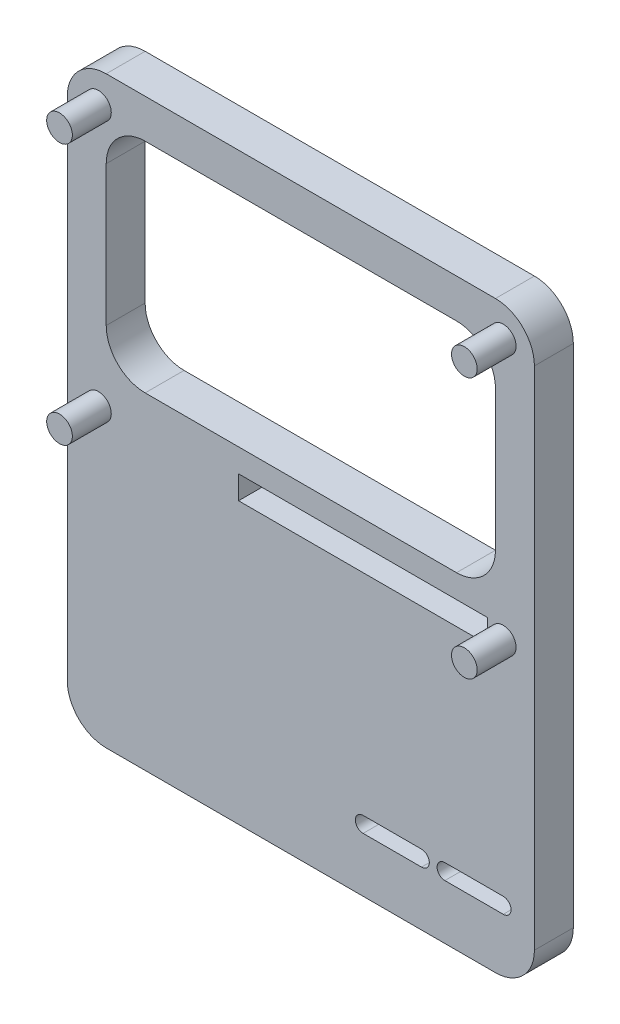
SolidWorks part; units mm, degrees
ref_plane "Alzado" through (0, 0, 0) normal (0, 0, 1) x (1, 0, 0)
ref_plane "Planta" through (0, 0, 0) normal (0, 1, 0) x (1, 0, 0)
ref_plane "Vista lateral" through (0, 0, 0) normal (1, 0, 0) x (0, 0, -1)
sketch "Croquis1" plane through (0, 0, 0) normal (0, 0, 1) x (1, 0, 0)
  line L0 (-15, -17.5) -> (-5, -17.5)
  line L1 (-25, 37.5) -> (25, 37.5)
  line L2 (-30, 32.5) -> (-30, -32.5)
  line L3 (-25, -37.5) -> (25, -37.5)
  line L4 (30, 32.5) -> (30, -32.5)
  line L5 (-30, 37.5) -> (30, -37.5) construction
  line L6 (-30, -37.5) -> (30, 37.5) construction
  line L7 (-20, 32.5) -> (20, 32.5)
  line L8 (-25, 27.5) -> (-25, 9.5)
  line L9 (-20, 4.5) -> (20, 4.5)
  line L10 (25, 27.5) -> (25, 9.5)
  line L11 (-25, 32.5) -> (25, 4.5) construction
  line L12 (-25, 4.5) -> (25, 32.5) construction
  line L13 (-5, -17.5) -> (-10, -8.8397)
  line L14 (-10, -8.8397) -> (-15, -17.5)
  line L16 (-8, 1.5) -> (24, 1.5)
  line L17 (-8, 1.5) -> (-8, -1.5)
  line L18 (-8, -1.5) -> (24, -1.5)
  line L19 (24, 1.5) -> (24, -1.5)
  line L20 (-8, 1.5) -> (24, -1.5) construction
  line L21 (-8, -1.5) -> (24, 1.5) construction
  line L33 (16, -9.5) -> (12, -9.5)
  line L34 (24, -9.5) -> (20, -9.5)
  line L35 (24, -9.5) -> (24, -13.5)
  line L36 (24, -13.5) -> (20, -13.5)
  line L37 (12, -9.5) -> (12, -13.5)
  line L38 (20, -5.5) -> (16, -5.5)
  line L39 (20, -5.5) -> (20, -9.5)
  line L40 (20, -17.5) -> (16, -17.5)
  line L41 (16, -5.5) -> (16, -9.5)
  line L42 (16, -13.5) -> (12, -13.5)
  line L43 (16, -13.5) -> (16, -17.5)
  line L44 (20, -13.5) -> (20, -17.5)
  line L45 (26, -29.5) -> (18.5, -29.5) construction
  line L46 (26, -30.5) -> (18.5, -30.5)
  line L47 (26, -28.5) -> (18.5, -28.5)
  line L48 (15.5, -29.5) -> (8, -29.5) construction
  line L49 (15.5, -30.5) -> (8, -30.5)
  line L50 (15.5, -28.5) -> (8, -28.5)
  arc A0 (30, 32.5) -> (25, 37.5) centre (25, 32.5) ccw
  arc A1 (25, -37.5) -> (30, -32.5) centre (25, -32.5) ccw
  arc A2 (-30, -32.5) -> (-25, -37.5) centre (-25, -32.5) ccw
  arc A3 (-25, 37.5) -> (-30, 32.5) centre (-25, 32.5) ccw
  arc A4 (25, 27.5) -> (20, 32.5) centre (20, 27.5) ccw
  arc A5 (20, 4.5) -> (25, 9.5) centre (20, 9.5) ccw
  arc A6 (-25, 9.5) -> (-20, 4.5) centre (-20, 9.5) ccw
  arc A7 (-20, 32.5) -> (-25, 27.5) centre (-20, 27.5) ccw
  circle A8 centre (-12, -26.5) radius 6
  circle A9 centre (-22, -17.5) radius 3.5
  circle A10 centre (-18, 0) radius 2.5
  arc A11 (26, -30.5) -> (26, -28.5) centre (26, -29.5) ccw
  arc A12 (18.5, -28.5) -> (18.5, -30.5) centre (18.5, -29.5) ccw
  arc A13 (15.5, -30.5) -> (15.5, -28.5) centre (15.5, -29.5) ccw
  arc A14 (8, -28.5) -> (8, -30.5) centre (8, -29.5) ccw
  point P0 (0, 0)
  point P18 (0, 18.5)
  point P45 (8, 0)
  point P50 (24, 0)
  point P64 (22.25, -29.5)
  point P69 (11.75, -29.5)
  dimension "D3" = 5
  dimension "D4" = 5
  dimension "D9" = 12
  dimension "D12" = 7
  dimension "D19" = 5
  dimension "D36" = 1
  dimension "D37" = 1
  dimension "D1" = 75
  dimension "D2" = 60
  dimension "D5" = 28
  dimension "D6" = 50
  dimension "D7" = 5
  dimension "D8" = 5
  dimension "D10" = 11
  dimension "D11" = 18
  dimension "D13" = 8
  dimension "D14" = 20
  dimension "D15" = 10
  dimension "D16" = 10
  dimension "D17" = 10
  dimension "D18" = 20
  dimension "D20" = 12
  dimension "D21" = 4.5
  dimension "D22" = 6
  dimension "D23" = 3
  dimension "D24" = 32
  dimension "D25" = 4.5
  dimension "D26" = 4
  dimension "D27" = 4
  dimension "D28" = 4
  dimension "D29" = 4
  dimension "D30" = 4
  dimension "D31" = 4
  dimension "D32" = 6
  dimension "D33" = 4
  dimension "D34" = 7.5
  dimension "D35" = 4
  dimension "D38" = 7.5
  dimension "D39" = 3
  dimension "D40" = 8
extrude "Saliente-Extruir4" add sketch "Croquis1" along normal blind 5
sketch "Croquis5" plane through (0, 0, 5) normal (0, 0, 1) x (1, 0, 0)
  line L5 (-30, 32.5) -> (-30, -32.5) construction
  line L6 (-20, 4.5) -> (20, 4.5) construction
  line L7 (0, -11.8908) -> (0, 21.542) construction
  line L8 (-12.0446, 0) -> (12.309, 0) construction
  line L10 (25, 37.5) -> (-25, 37.5) construction
  circle A3 centre (-26, 0) radius 1.65
  circle A4 centre (26, 0) radius 1.65
  circle A5 centre (-26, 33.5) radius 1.65
  circle A6 centre (26, 33.5) radius 1.65
  dimension "D1" = 3.3
  dimension "D2" = 4
  dimension "D3" = 4.5
  dimension "D4" = 3.3
  dimension "D5" = 4
  dimension "D6" = 4
extrude "Saliente-Extruir6" add sketch "Croquis5" along normal blind 5
sketch "Croquis6" plane through (0, 0, 5) normal (0, 0, 1) x (1, 0, 0)
  line L0 (-15, -17.5) -> (-10, -8.8397)
  line L1 (-10, -8.8397) -> (-5, -17.5)
  line L2 (-5, -17.5) -> (-15, -17.5)
  line L3 (20, -13.5) -> (20, -17.5)
  line L4 (20, -17.5) -> (16, -17.5)
  line L5 (16, -17.5) -> (16, -13.5)
  line L6 (16, -13.5) -> (12, -13.5)
  line L7 (12, -13.5) -> (12, -9.5)
  line L8 (12, -9.5) -> (16, -9.5)
  line L9 (16, -9.5) -> (16, -5.5)
  line L10 (16, -5.5) -> (20, -5.5)
  line L11 (20, -5.5) -> (20, -9.5)
  line L12 (20, -9.5) -> (24, -9.5)
  line L13 (24, -9.5) -> (24, -13.5)
  line L14 (24, -13.5) -> (20, -13.5)
  circle A0 centre (-22, -17.5) radius 3.5
  circle A1 centre (-12, -26.5) radius 6
  circle A2 centre (-18, 0) radius 2.5
  dimension "D1" = 12
  dimension "D2" = 7
  dimension "D3" = 5
extrude "Saliente-Extruir7" add sketch "Croquis6" against normal blind 7.5
chamfer "Chaflán1" distance 0.5 angle 45 12 edges at (24, -11.5, -2.5) (22, -9.5, -2.5) (20, -7.5, -2.5) (18, -5.5, -2.5) (16, -7.5, -2.5) (14, -9.5, -2.5) (12, -11.5, -2.5) (14, -13.5, -2.5) (16, -15.5, -2.5) (18, -17.5, -2.5) (20, -15.5, -2.5) (22, -13.5, -2.5)
chamfer "Chaflán2" distance 0.5 angle 45 3 edges at (-7.5, -13.1699, -2.5) (-12.5, -13.1699, -2.5) (-10, -17.5, -2.5)
chamfer "Chaflán3" distance 0.5 angle 45 1 edges at (-6, -26.5, -2.5)
chamfer "Chaflán4" distance 0.5 angle 45 1 edges at (-18.5, -17.5, -2.5)
chamfer "Chaflán5" distance 0.5 angle 45 1 edges at (-15.5, 0, -2.5)
scale "Scale1" bodies to scale 107 scale about centroid uniform scaling yes scale factor 0.733333
